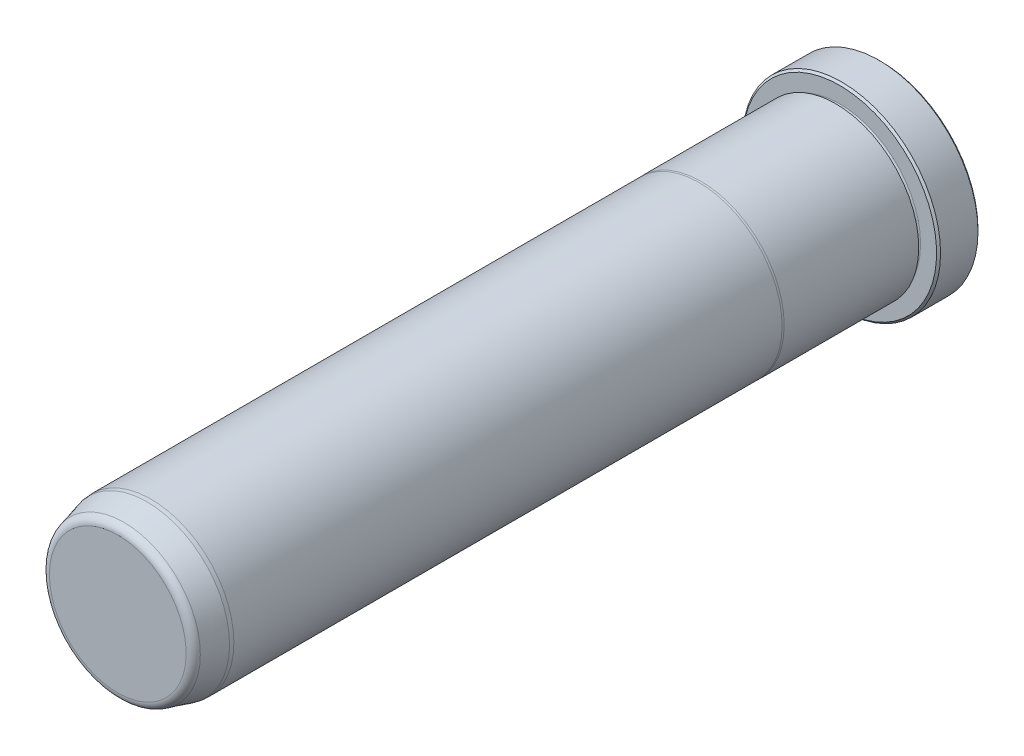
SolidWorks part; units mm, degrees
ref_plane "Front Plane" through (0, 0, 0) normal (0, 0, 1) x (1, 0, 0)
ref_plane "Top Plane" through (0, 0, 0) normal (0, 1, 0) x (1, 0, 0)
ref_plane "Right Plane" through (0, 0, 0) normal (1, 0, 0) x (0, 0, -1)
sketch "Sketch1" plane through (0, 0, 0) normal (1, 0, 0) x (0, 0, -1)
  line L0 (0, 0) -> (0, 18.923)
  line L1 (0, 18.923) -> (-7.9248, 18.923)
  line L2 (-7.9248, 18.923) -> (-7.9248, 15.4813)
  line L3 (-4.7498, 15.1003) -> (-5.5118, 15.1003) construction
  line L4 (-8.6868, 15.4813) -> (-8.6868, 15.8877)
  line L5 (-8.6868, 15.8877) -> (-34.4348, 15.8877)
  line L6 (-34.4348, 15.8877) -> (-34.798, 15.8623)
  line L7 (-34.798, 15.8623) -> (-139.7, 15.8623)
  line L9 (-146.05, 14.2983) -> (-146.05, 0)
  line L10 (-146.05, 0) -> (0, 0)
  line L11 (0, 0) -> (13.6287, 0) construction
  line L12 (-139.7, 15.8623) -> (-140.462, 15.7956)
  line L13 (-140.462, 15.7956) -> (-146.05, 14.2983)
  arc A0 (-8.6868, 15.4813) -> (-7.9248, 15.4813) centre (-8.3058, 15.4813) ccw
  dimension "D14" = 0.762
  dimension "D1" = 7.9248
  dimension "D2" = 0.762
  dimension "D3" = 37.846
  dimension "D4" = 31.7754
  dimension "D5" = 34.798
  dimension "D6" = 146.05
  dimension "D7" = 0.7874
  dimension "D8" = 4
  dimension "D9" = 31.7246
  dimension "D10" = 5
  dimension "D11" = 15
  dimension "D12" = 0.762
  dimension "D13" = 6.35
revolve "Revolve1" add sketch "Sketch1" angle 360 about L11
fillet "Fillet6" radius 1.5875 1 edges at (14.2983, 0, 146.05)
chamfer "Chamfer1" distance 0.381 angle 45 2 edges at (18.923, 0, 0) (18.923, 0, 7.9248)
